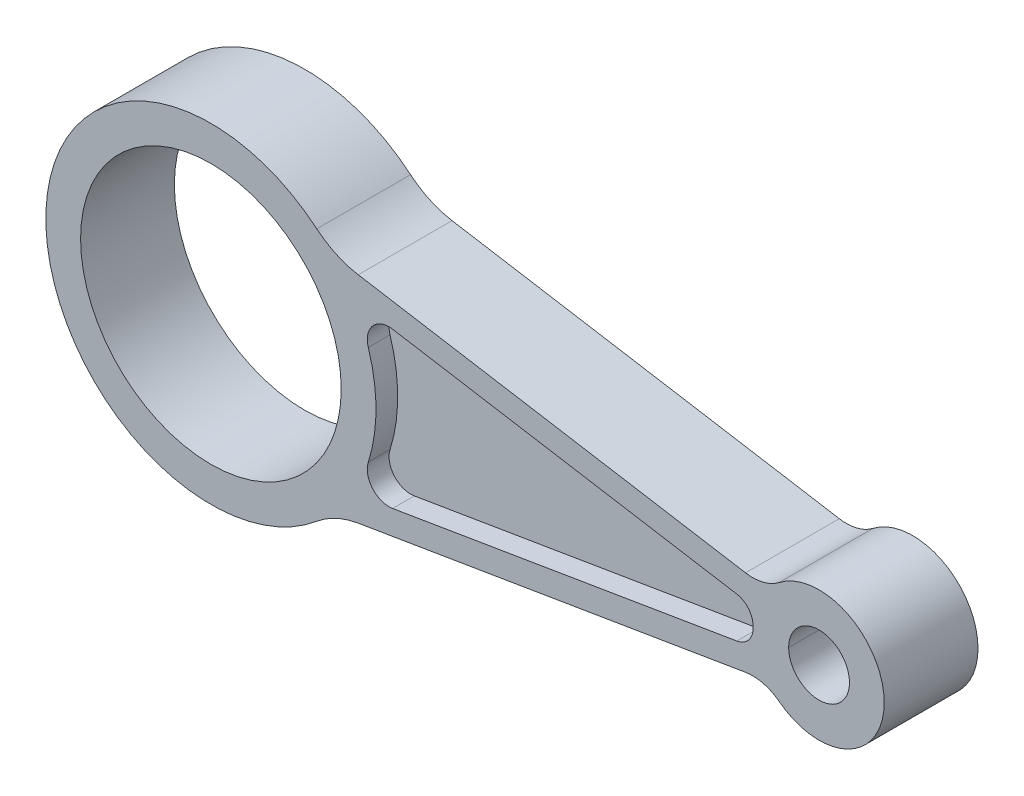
SolidWorks part; units mm, degrees
ref_plane "Front" through (0, 0, 0) normal (0, 0, 1) x (1, 0, 0)
ref_plane "Top" through (0, 0, 0) normal (0, 1, 0) x (1, 0, 0)
ref_plane "Right" through (0, 0, 0) normal (1, 0, 0) x (0, 0, -1)
sketch "Sketch1" plane through (0, 0, 0) normal (0, 0, 1) x (1, 0, 0)
  line L0 (-42.1775, 0) -> (237.8949, 0) construction
  line L1 (27.9355, 25.7606) -> (128.0638, 9.0844)
  line L2 (27.9355, -25.7606) -> (128.0638, -9.0844)
  arc A0 (27.9355, 25.7606) -> (27.9355, -25.7606) centre (0, 0) ccw
  arc A1 (128.0638, -9.0844) -> (128.0638, 9.0844) centre (140, 0) ccw
  circle A2 centre (0, 0) radius 30
  circle A3 centre (140, 0) radius 7
  dimension "D1" = 76
  dimension "D3" = 60
  dimension "D4" = 14
  dimension "D5" = 30
  dimension "D2" = 140
extrude "Base-Extrude" add sketch "Sketch1" against normal blind 21.5898
fillet "Fillet1" radius 10 2 edges at (128.0638, 9.0844, -10.7949) (128.0638, -9.0844, -10.7949)
fillet "Fillet2" radius 20 2 edges at (27.9355, 25.7606, -10.7949) (27.9355, -25.7606, -10.7949)
sketch "Sketch2" plane through (0, 0, 0) normal (0, 0, 1) x (1, 0, 0)
  line L0 (41.8286, 17.871) -> (121.0469, 4.6773)
  line L1 (123.0688, 9.9163) -> (33.9231, 24.7634) construction
  line L2 (41.8286, -17.871) -> (121.0718, -4.6731)
  line L3 (33.9231, -24.7634) -> (123.0688, -9.9163) construction
  arc A0 (36.2389, -11.4344) -> (36.2389, 11.4344) centre (0, 0) ccw
  arc A3 (36.2389, 11.4344) -> (41.8286, 17.871) centre (41.0071, 12.9389) cw
  arc A4 (41.8286, -17.871) -> (36.2389, -11.4344) centre (41.0071, -12.9389) cw
  arc A5 (124.8077, 0.2384) -> (121.0469, 4.6773) centre (120.3077, 0.2384) ccw
  arc A6 (124.8077, 0.2384) -> (121.0718, -4.6731) centre (120.3325, -0.2343) cw
  dimension "D1" = 76
  dimension "D5" = 5
  dimension "D6" = 5
  dimension "D7" = 4.5
  dimension "D8" = 4.5
  dimension "D3" = 5.5
  dimension "D4" = 5.5
extrude "Cut-Extrude1" cut sketch "Sketch2" against normal blind 5
sketch "Sketch3" plane through (0, 0, -21.5898) normal (0, 0, -1) x (-1, 0, 0)
  line L0 (-121.4456, 4.6109) -> (-41.8286, 17.871)
  line L1 (-123.0688, 9.9163) -> (-33.9231, 24.7634) construction
  line L2 (-121.4335, -4.6129) -> (-41.8286, -17.871)
  line L3 (-33.9231, -24.7634) -> (-123.0688, -9.9163) construction
  arc A0 (-36.2389, 11.4344) -> (-36.2389, -11.4344) centre (0, 0) ccw
  arc A1 (-41.8286, 17.871) -> (-36.2389, 11.4344) centre (-41.0071, 12.9389) cw
  arc A3 (-125.1942, -0.1579) -> (-121.4456, 4.6109) centre (-120.7063, 0.172) cw
  arc A4 (-125.1942, -0.1579) -> (-121.4335, -4.6129) centre (-120.6942, -0.174) ccw
  arc A5 (-41.8286, -17.871) -> (-36.2389, -11.4344) centre (-41.0071, -12.9389) ccw
  dimension "D1" = 76
  dimension "D2" = 5
  dimension "D5" = 4.5
  dimension "D6" = 4.5
  dimension "D7" = 5
  dimension "D3" = 5.5
  dimension "D4" = 5.5
extrude "Cut-Extrude2" cut sketch "Sketch3" against normal blind 5
sketch "Sketch4" plane through (0, 0, 0) normal (0, 0, 1) x (1, 0, 0)
  line L0 (133, 0) -> (147, 0)
  circle A0 centre (140, 0) radius 7 construction
